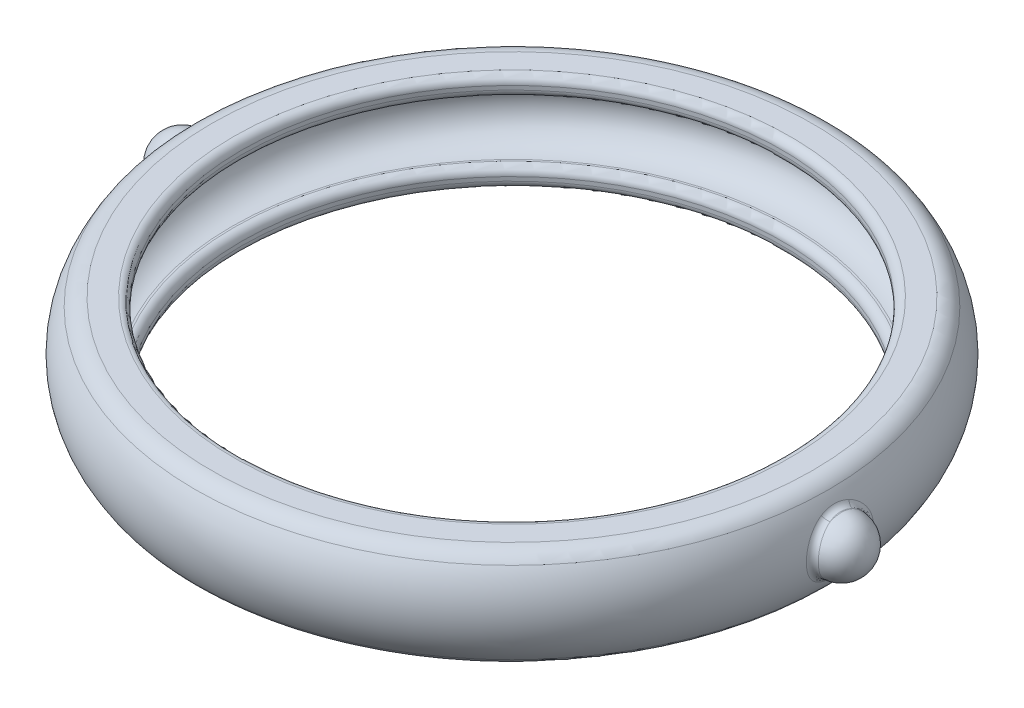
SolidWorks part; units mm, degrees
ref_plane "前视基准面" through (0, 0, 0) normal (0, 0, 1) x (1, 0, 0)
ref_plane "上视基准面" through (0, 0, 0) normal (0, 1, 0) x (1, 0, 0)
ref_plane "右视基准面" through (0, 0, 0) normal (1, 0, 0) x (0, 0, -1)
sketch "草图1" plane through (0, 0, 0) normal (0, 0, 1) x (1, 0, 0)
  line L0 (0, 18.5238) -> (0, -10.9048) construction
  line L2 (14.1, 0) -> (15.2292, 0)
  line L3 (13.7, 0.4) -> (13.7, 0.6)
  line L4 (14.1, 5) -> (15.2292, 5)
  line L6 (15.7, 5.7484) -> (15.7, -1.0538) construction
  line L7 (12.3947, 4) -> (16.0705, 4) construction
  line L8 (12.3947, 1) -> (16.0705, 1) construction
  line L9 (14.2, 5.6525) -> (14.2, -0.1978) construction
  line L10 (13.7, 4.4) -> (13.7, 4.6)
  line L11 (14.1, 4) -> (14.2, 4)
  line L12 (14.1, 1) -> (14.2, 1)
  arc A0 (14.2, 1) -> (14.2, 4) centre (14.2, 2.5) ccw
  arc A1 (16.0499, 4.5714) -> (16.0499, 0.4286) centre (13.075, 2.5) cw
  arc A2 (14.1, 0) -> (13.7, 0.4) centre (14.1, 0.4) cw
  arc A3 (13.7, 0.6) -> (14.1, 1) centre (14.1, 0.6) cw
  arc A4 (13.7, 4.4) -> (14.1, 4) centre (14.1, 4.4) ccw
  arc A5 (13.7, 4.6) -> (14.1, 5) centre (14.1, 4.6) cw
  arc A6 (16.0499, 0.4286) -> (15.2292, 0) centre (15.2292, 1) cw
  arc A7 (16.0499, 4.5714) -> (15.2292, 5) centre (15.2292, 4) ccw
  point P22 (13.7, 1)
  point P28 (13.7, 4)
  point P33 (15.7, 0)
  point P36 (15.7, 5)
  dimension "D3" = 1
  dimension "D1" = 16.7
  dimension "D2" = 0.4
  dimension "D4" = 0.5
revolve "旋转1" add sketch "草图1" angle 360 about L0
ref_plane "基准面1" through (16.7, 0, 0) normal (1, 0, 0) x (0, 0, -1)
sketch "草图4" plane through (16.7, 0, 0) normal (1, 0, 0) x (0, 0, -1)
  line L0 (-16.7, 2.5) -> (16.7, 2.5) construction
  line L1 (0, -2.5) -> (0, 2.5) construction
  line L2 (-16.7, 2.5) -> (16.7, 2.5) construction
  circle A0 centre (0, 2.5) radius 1.4
  arc A1 (-16.0499, 4.5714) -> (-16.0499, 0.4286) centre (-13.075, 2.5) ccw construction
  arc A2 (16.0499, 0.4286) -> (16.0499, 4.5714) centre (13.075, 2.5) ccw construction
  point P14 (0, 0)
  dimension "D1" = 2.8
  dimension "D2" = 0
extrude "凸台-拉伸1" add sketch "草图4" against normal up to next
sketch "草图5" plane through (16.7, 0, 0) normal (1, 0, 0) x (0, 0, -1)
  line L0 (0, 3.9) -> (0, 1.1)
  circle A0 centre (0, 2.5) radius 1.4 construction
  arc A1 (0, 1.1) -> (0, 3.9) centre (0, 2.5) ccw
revolve "旋转2" add sketch "草图5" angle 180 about L0
ref_plane "基准面2" through (-16.7, 0, 0) normal (1, 0, 0) x (0, 0, -1)
sketch "草图6" plane through (-16.7, 0, 0) normal (1, 0, 0) x (0, 0, -1)
  circle A0 centre (0, 2.5) radius 1.4 construction
  circle A1 centre (0, 2.5) radius 1.4
extrude "凸台-拉伸2" add sketch "草图6" along normal up to next
sketch "草图7" plane through (-16.7, 0, 0) normal (-1, 0, 0) x (0, 0, 1)
  line L0 (0, 1.1) -> (0, 3.9)
  circle A0 centre (0, 2.5) radius 1.4 construction
  arc A1 (0, 1.1) -> (0, 3.9) centre (0, 2.5) ccw
revolve "旋转3" add sketch "草图7" angle 180 about L0
fillet "圆角1" radius 0.35 2 edges at (-16.4949, 3.6443, 0.8066) (16.5633, 3.3413, 1.119)
